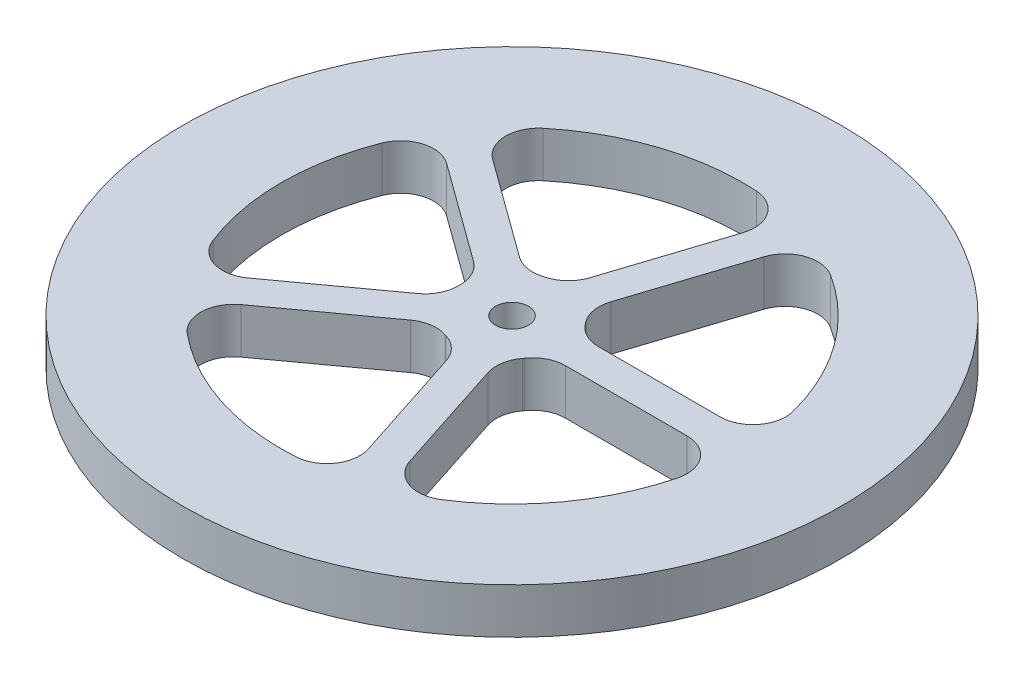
SolidWorks part; units mm, degrees
ref_plane "Front Plane" through (0, 0, 0) normal (0, 0, 1) x (1, 0, 0)
ref_plane "Top Plane" through (0, 0, 0) normal (0, 1, 0) x (1, 0, 0)
ref_plane "Right Plane" through (0, 0, 0) normal (1, 0, 0) x (0, 0, -1)
sketch "Sketch1" plane through (0, 0, 0) normal (0, 1, 0) x (1, 0, 0)
  circle A0 centre (0, 0) radius 63.5
  circle A1 centre (0, 0) radius 3.175
  dimension "D1" = 127
extrude "Boss-Extrude1" add sketch "Sketch1" along normal blind 8.763
sketch "Sketch2" plane through (0, 8.763, 0) normal (0, 1, 0) x (1, 0, 0)
  line L0 (8.1391, 6.0812) -> (8.2987, 5.8615)
  line L1 (13.4853, 3.175) -> (36.8902, 3.175)
  line L2 (8.2987, -5.8615) -> (8.1391, -6.0812)
  line L3 (7.1868, -11.8442) -> (14.4193, -34.1035)
  line L4 (13.4853, -3.175) -> (36.8902, -3.175)
  line L5 (-3.0102, -9.7038) -> (-3.2684, -9.6199)
  line L6 (-9.0437, -10.4951) -> (-27.9786, -24.2521)
  line L7 (1.1476, -13.8065) -> (8.3801, -36.0658)
  line L8 (7.1868, 11.8442) -> (14.4193, 34.1035)
  line L9 (-10.1591, -0.1358) -> (-10.1591, 0.1358)
  line L10 (0, 0) -> (83.8305, 0) construction
  line L11 (-12.7761, 5.3579) -> (-31.711, 19.1149)
  line L12 (9.6512, -3.175) -> (44.3365, -3.175)
  line L14 (-0.0372, -10.1599) -> (10.6811, -43.1476)
  line L16 (-9.6742, -3.1042) -> (-37.7352, -23.4917)
  line L18 (-5.9417, 8.2414) -> (-34.0027, 28.6289)
  line L20 (-12.7761, -5.3579) -> (-31.711, -19.1149)
  line L21 (-3.2684, 9.6199) -> (-3.0102, 9.7038)
  line L22 (1.1476, 13.8065) -> (8.3801, 36.0658)
  line L23 (-9.0437, 10.4951) -> (-27.9786, 24.2521)
  circle A0 centre (0, 0) radius 10.16 construction
  circle A1 centre (0, 0) radius 44.45 construction
  arc A2 (43.0385, 11.1125) -> (23.8683, 37.4981) centre (0, 0) ccw
  arc A3 (23.8683, -37.4981) -> (43.0385, -11.1125) centre (0, 0) ccw
  arc A4 (8.1391, 6.0812) -> (7.1868, 11.8442) centre (13.226, 9.8819) cw
  arc A5 (13.4853, 3.175) -> (8.2987, 5.8615) centre (13.4853, 9.525) cw
  arc A6 (36.8902, 3.175) -> (43.0385, 11.1125) centre (36.8902, 9.525) ccw
  arc A7 (23.8683, 37.4981) -> (14.4193, 34.1035) centre (20.4585, 32.1412) ccw
  arc A8 (8.2987, -5.8615) -> (13.4853, -3.175) centre (13.4853, -9.525) cw
  arc A9 (7.1868, -11.8442) -> (8.1391, -6.0812) centre (13.226, -9.8819) cw
  arc A10 (14.4193, -34.1035) -> (23.8683, -37.4981) centre (20.4585, -32.1412) ccw
  arc A11 (43.0385, -11.1125) -> (36.8902, -3.175) centre (36.8902, -9.525) ccw
  arc A12 (-28.2871, -34.2876) -> (2.731, -44.366) centre (0, 0) ccw
  arc A13 (-3.0102, -9.7038) -> (1.1476, -13.8065) centre (-4.8916, -15.7687) cw
  arc A14 (-9.0437, -10.4951) -> (-3.2684, -9.6199) centre (-5.3112, -15.6324) cw
  arc A15 (-27.9786, -24.2521) -> (-28.2871, -34.2876) centre (-24.2461, -29.3894) ccw
  arc A16 (2.731, -44.366) -> (8.3801, -36.0658) centre (2.3409, -38.028) ccw
  arc A17 (-41.3507, 16.3072) -> (-41.3507, -16.3072) centre (0, 0) ccw
  arc A18 (-10.1591, -0.1358) -> (-12.7761, -5.3579) centre (-16.5085, -0.2206) cw
  arc A19 (-12.7761, 5.3579) -> (-10.1591, 0.1358) centre (-16.5085, 0.2206) cw
  arc A20 (-31.711, 19.1149) -> (-41.3507, 16.3072) centre (-35.4434, 13.9776) ccw
  arc A21 (-41.3507, -16.3072) -> (-31.711, -19.1149) centre (-35.4434, -13.9776) ccw
  arc A22 (2.731, 44.366) -> (-28.2871, 34.2876) centre (0, 0) ccw
  arc A23 (-3.2684, 9.6199) -> (-9.0437, 10.4951) centre (-5.3112, 15.6324) cw
  arc A24 (1.1476, 13.8065) -> (-3.0102, 9.7038) centre (-4.8916, 15.7687) cw
  arc A25 (8.3801, 36.0658) -> (2.731, 44.366) centre (2.3409, 38.028) ccw
  arc A26 (-28.2871, 34.2876) -> (-27.9786, 24.2521) centre (-24.2461, 29.3894) ccw
  point P12 (9.6512, 3.175)
  point P15 (44.3365, 3.175)
  point P46 (6.002, -8.1977)
  point P60 (-5.9417, -8.2414)
  point P74 (-9.6742, 3.1042)
  point P88 (-0.0372, 10.1599)
  dimension "D1" = 3.175
  dimension "D3" = 6.35
  dimension "D4" = 5
extrude "Cut-Extrude1" cut sketch "Sketch2" against normal through all
